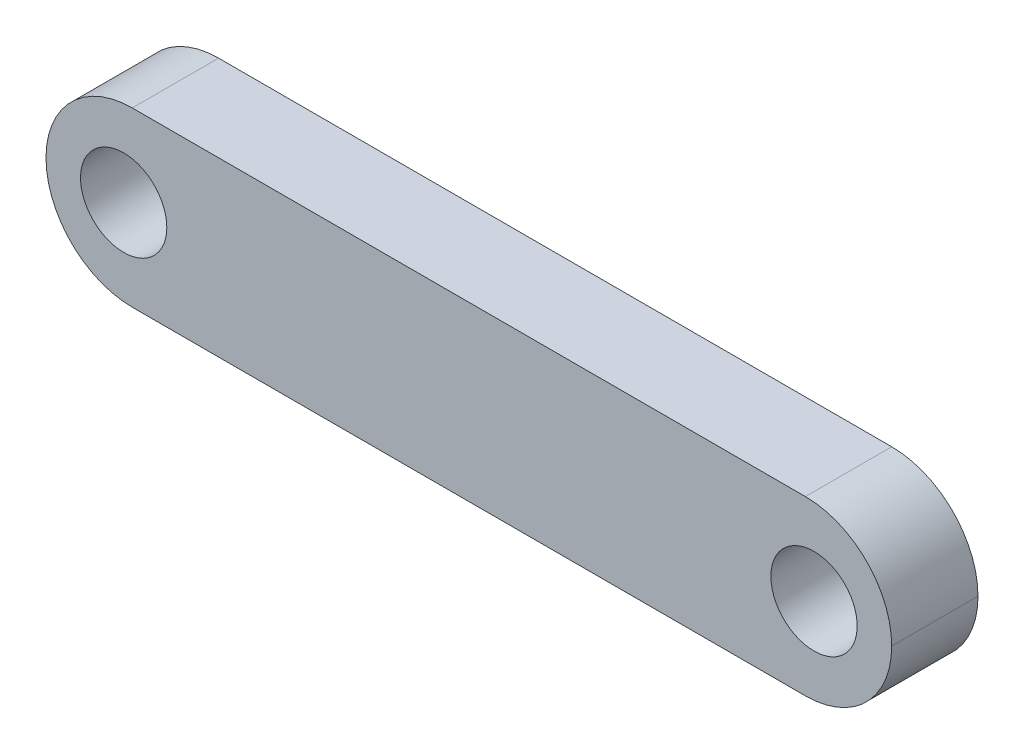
SolidWorks part; units mm, degrees
ref_plane "前视基准面" through (0, 0, 0) normal (0, 0, 1) x (1, 0, 0)
ref_plane "上视基准面" through (0, 0, 0) normal (0, 1, 0) x (1, 0, 0)
ref_plane "右视基准面" through (0, 0, 0) normal (1, 0, 0) x (0, 0, -1)
other "Configuration Table"
sketch "草图1" plane through (0, 0, 0) normal (0, 0, 1) x (1, 0, 0)
  line L1 (24.5, -5) -> (-24.5, -5)
  line L2 (24.5, -5) -> (24.5, 5)
  line L3 (24.5, 5) -> (-24.5, 5)
  line L4 (-24.5, -5) -> (-24.5, 5)
  line L5 (24.5, -5) -> (-24.5, 5) construction
  line L6 (24.5, 5) -> (-24.5, -5) construction
  point P0 (0, 0)
  dimension "D1" = 49
  dimension "D2" = 10
extrude "凸台-拉伸1" add sketch "草图1" along normal blind 5
fillet "圆角1" radius 5 4 edges at (24.5, -5, 2.5) (24.5, 5, 2.5) (-24.5, -5, 2.5) (-24.5, 5, 2.5)
sketch "草图2" plane through (0, 0, 5) normal (0, 0, 1) x (1, 0, 0)
  line L0 (0, 7.85) -> (0, -12.5006)
  circle A0 centre (-20, 0) radius 2.5
  circle A1 centre (20, 0) radius 2.5
  dimension "D1" = 5
  dimension "D2" = 20
extrude "切除-拉伸1" cut sketch "草图2" against normal blind 5 contours A1 | A0
